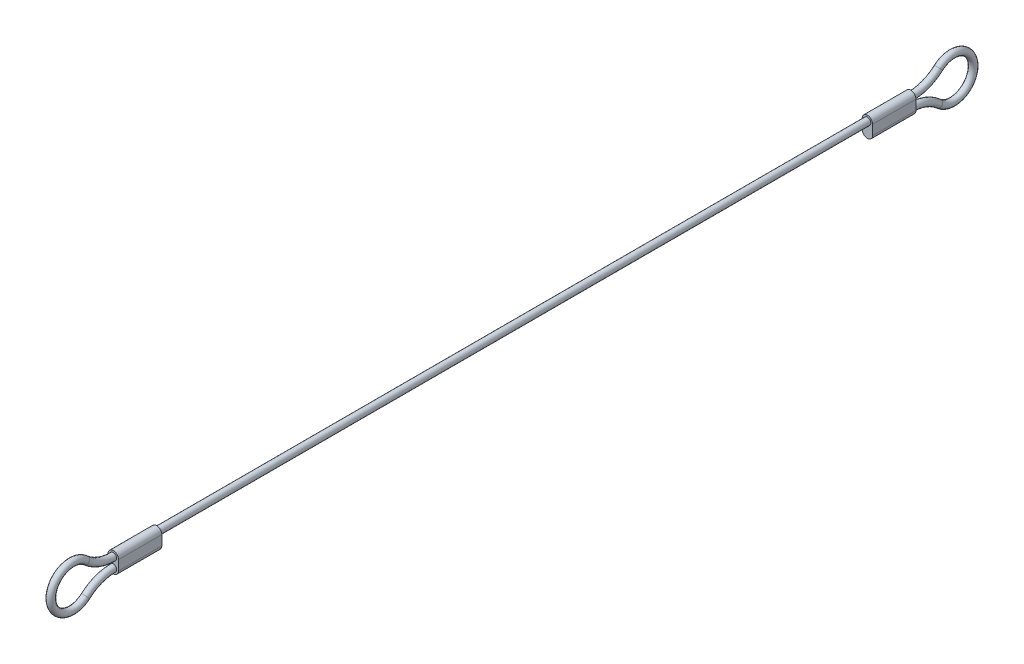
SolidWorks part; units mm, degrees
ref_plane "Front Plane" through (0, 0, 0) normal (0, 0, 1) x (1, 0, 0)
ref_plane "Top Plane" through (0, 0, 0) normal (0, 1, 0) x (1, 0, 0)
ref_plane "Right Plane" through (0, 0, 0) normal (1, 0, 0) x (0, 0, -1)
sketch "Sketch1" plane through (0, 0, 0) normal (1, 0, 0) x (0, 0, -1)
  line L0 (92, 0) -> (-92, 0)
  line L1 (0, 2.1945) -> (0, -2.1945) construction
  arc A0 (-92, 0) -> (-98.4, 2.4446) centre (-92, 9.6) cw
  arc A1 (-98.4, 2.4446) -> (-98.4, -4.7108) centre (-101.6, -1.1331) ccw
  arc A2 (-98.4, -4.7108) -> (-92, -2.2663) centre (-92, -11.8663) cw
  arc A3 (98.4, -4.7108) -> (92, -2.2663) centre (92, -11.8663) ccw
  arc A4 (98.4, 2.4446) -> (98.4, -4.7108) centre (101.6, -1.1331) cw
  arc A5 (92, 0) -> (98.4, 2.4446) centre (92, 9.6) ccw
  point P18 (0, 0)
  dimension "D1" = 4.8
  dimension "D4" = 9.6
  dimension "D2" = 101.6
  dimension "D3" = 9.6
sketch "Sketch2" plane through (0, 0, 0) normal (0, 0, 1) x (1, 0, 0)
  circle A0 centre (0, 0) radius 0.795
  dimension "D1" = 1.59
sweep "Sweep1" add profiles "Sketch2" path "Sketch1"
sketch "Sketch3" plane through (0, 0, 92) normal (0, 0, -1) x (-1, 0, 0)
  line L0 (0, 0) -> (0, -2.2663) construction
  line L1 (1.2, 0) -> (1.2, -2.2663)
  line L2 (-1.2, 0) -> (-1.2, -2.2663)
  line L3 (-0.795, -2.2663) -> (0.795, -2.2663) construction
  arc A0 (1.2, 0) -> (-1.2, 0) centre (0, 0) ccw
  arc A1 (-1.2, -2.2663) -> (1.2, -2.2663) centre (0, -2.2663) ccw
  point P3 (0, -1.1331)
  dimension "D1" = 2.4
extrude "Boss-Extrude1" add sketch "Sketch3" along normal blind 10
mirror "Mirror1" about plane through (0, 0, 0) normal (0, 0, 1) of "Boss-Extrude1"
